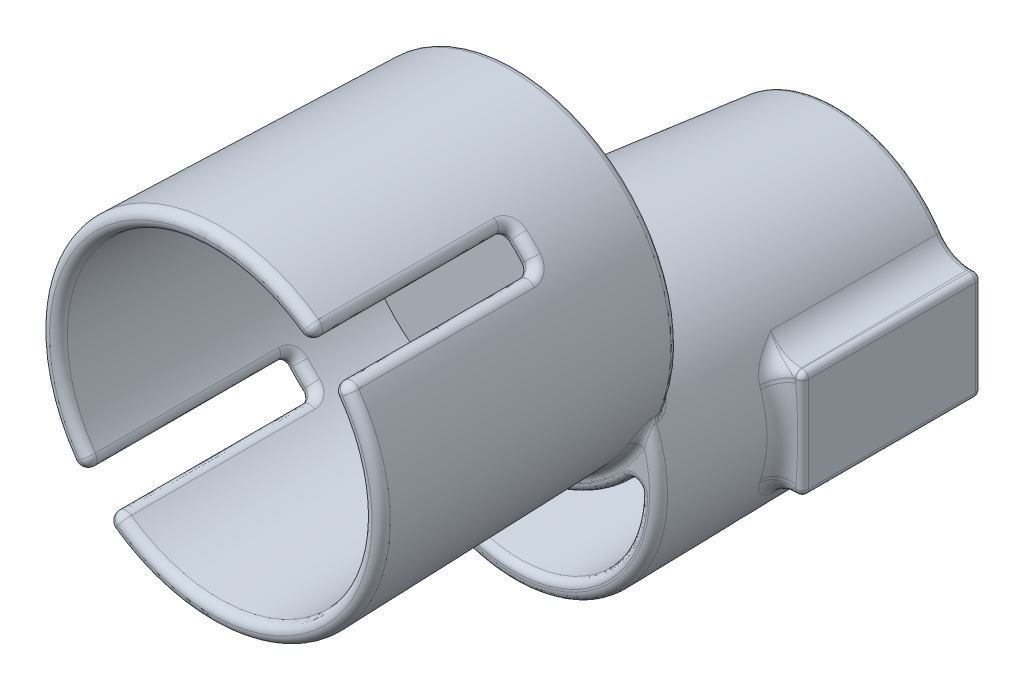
SolidWorks part; units mm, degrees
other "<Leaf Cupholder Left>-<Fillet6>"
ref_plane "Front Plane" through (0, 0, 0) normal (0, 0, 1) x (1, 0, 0)
ref_plane "Top Plane" through (0, 0, 0) normal (0, 1, 0) x (1, 0, 0)
ref_plane "Right Plane" through (0, 0, 0) normal (1, 0, 0) x (0, 0, -1)
ref_plane "Front Plane-Leaf Cupholder Left_Mirrored" through (0, 0, 0) normal (0, 0, 1) x (1, 0, 0)
ref_plane "Top Plane-Leaf Cupholder Left_Mirrored" through (0, 0, 0) normal (0, -1, 0) x (1, 0, 0)
ref_plane "Right Plane-Leaf Cupholder Left_Mirrored" through (0, 0, 0) normal (1, 0, 0) x (0, 0, -1)
ref_plane "Overlap Plane-Leaf Cupholder Left_Mirrored" through (0, 0, 85) normal (0, 0, 1) x (1, 0, 0)
ref_plane "Bottom of tumbler holder-Leaf Cupholder Left_Mirrored" through (0, 0, 165) normal (0, 0, 1) x (1, 0, 0)
ref_plane "Tumbler Bottom Plane-Leaf Cupholder Left_Mirrored" through (0, 0, 85) normal (0, 0, 1) x (1, 0, 0)
ref_plane "Tumbler Slice Plane-Leaf Cupholder Left_Mirrored" through (0, 0, 110) normal (0, 0, 1) x (1, 0, 0)
ref_plane "Coin Cavity Bottom Plane-Leaf Cupholder Left_Mirrored" through (0, 0, 10) normal (0, 0, 1) x (1, 0, 0)
mirrored part "Leaf Cupholder Left_Mirrored"
